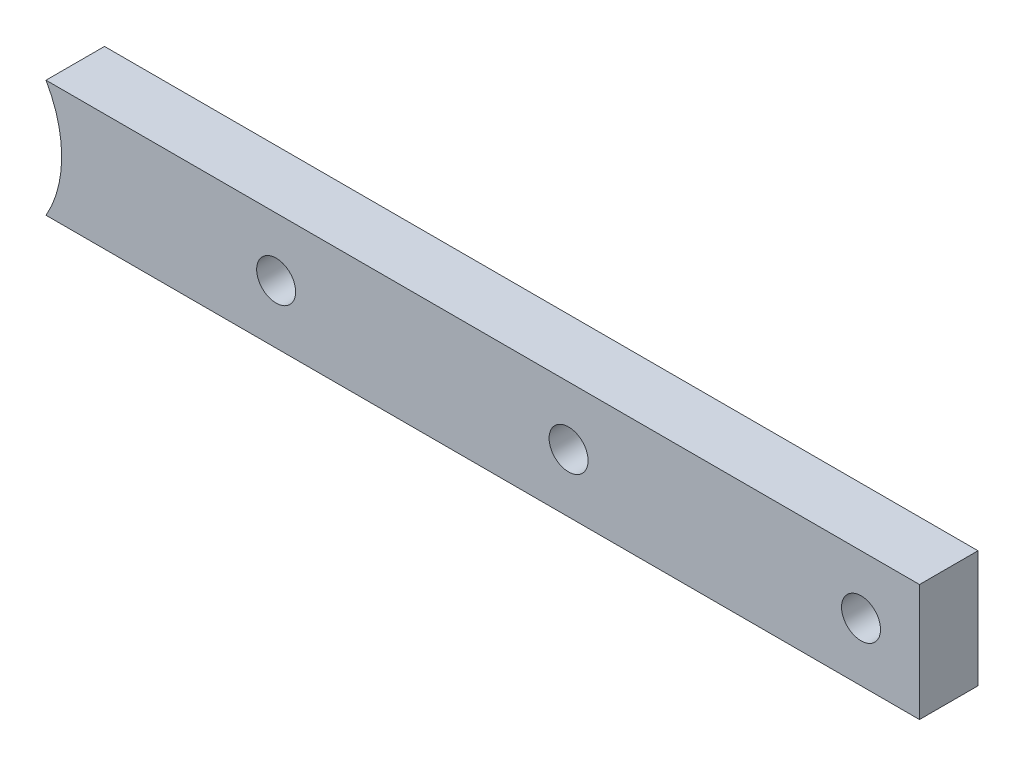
SolidWorks part; units mm, degrees
ref_plane "Face" through (0, 0, 0) normal (0, 0, 1) x (1, 0, 0)
ref_plane "Dessus" through (0, 0, 0) normal (0, 1, 0) x (1, 0, 0)
ref_plane "Droite" through (0, 0, 0) normal (1, 0, 0) x (0, 0, -1)
sketch "Esquisse1" plane through (0, 0, 0) normal (0, 0, 1) x (1, 0, 0)
  line L1 (51.9615, 30) -> (500, 30)
  line L3 (51.9615, -30) -> (500, -30)
  line L4 (500, 30) -> (500, -30)
  arc A0 (51.9615, -30) -> (51.9615, 30) centre (0, 0) ccw
  circle A1 centre (470, 0) radius 10
  circle A2 centre (320, 0) radius 10
  circle A3 centre (170, 0) radius 10
  point P12 (0, 0)
  point P13 (0, 0)
  dimension "D1" = 120
  dimension "D5" = 20
  dimension "D6" = 20
  dimension "D7" = 20
  dimension "D2" = 60
  dimension "D3" = 30
  dimension "D4" = 500
  dimension "D8" = 30
  dimension "D9" = 150
  dimension "D10" = 150
extrude "Extrusion1" add sketch "Esquisse1" along normal blind 30
